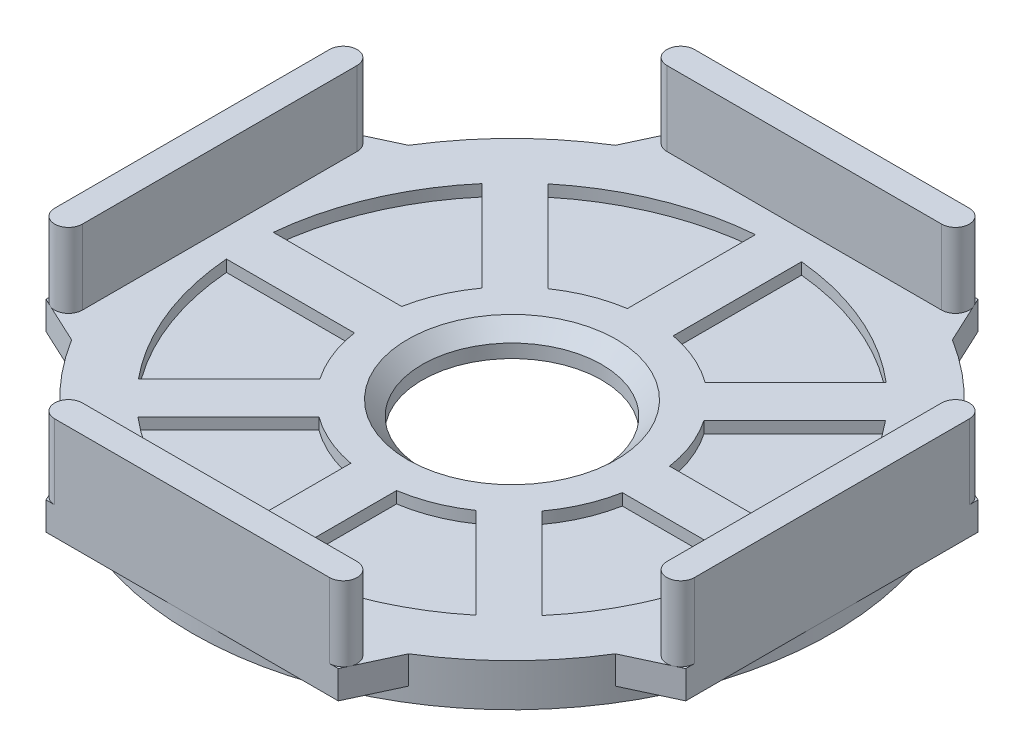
SolidWorks part; units mm, degrees
ref_plane "Plan de face" through (0, 0, 0) normal (0, 0, 1) x (1, 0, 0)
ref_plane "Plan de dessus" through (0, 0, 0) normal (0, 1, 0) x (1, 0, 0)
ref_plane "Plan de droite" through (0, 0, 0) normal (1, 0, 0) x (0, 0, -1)
sketch "Esquisse1" plane through (0, 0, 0) normal (0, 1, 0) x (1, 0, 0)
  line L0 (66.5432, 0) -> (-11.4074, 0) construction
  line L1 (0, 63.5556) -> (0, -15.7531) construction
  line L2 (44, 63.5556) -> (44, -28.5185) construction
  line L3 (66.5432, 20.1) -> (7.6049, 20.1) construction
  line L4 (44, 20.1) -> (29.5756, 26.8262) construction
  line L5 (37.4007, 23.1773) -> (44, 20.1)
  line L6 (37.4007, -23.1773) -> (44, -20.1)
  line L7 (44, 20.1) -> (44, -20.1)
  line L8 (-23.1773, -37.4007) -> (-20.1, -44)
  line L9 (20.1, -44) -> (-20.1, -44)
  line L10 (23.1773, -37.4007) -> (20.1, -44)
  line L11 (-37.4007, 23.1773) -> (-44, 20.1)
  line L12 (-44, -20.1) -> (-44, 20.1)
  line L13 (-37.4007, -23.1773) -> (-44, -20.1)
  line L14 (23.1773, 37.4007) -> (20.1, 44)
  line L15 (-20.1, 44) -> (20.1, 44)
  line L16 (-23.1773, 37.4007) -> (-20.1, 44)
  arc A0 (37.4007, 23.1773) -> (23.1773, 37.4007) centre (0, 0) ccw
  arc A1 (-23.1773, 37.4007) -> (-37.4007, 23.1773) centre (0, 0) ccw
  arc A2 (-37.4007, -23.1773) -> (-23.1773, -37.4007) centre (0, 0) ccw
  arc A3 (23.1773, -37.4007) -> (37.4007, -23.1773) centre (0, 0) ccw
  circle A4 centre (0, 0) radius 12.35
  point P30 (0, 0)
  point P32 (0, 0)
  dimension "D1" = 44
  dimension "D2" = 20.1
  dimension "D3" = 25
  dimension "D4" = 4
extrude "Boss.-Extru.1" add sketch "Esquisse1" along normal blind 3.85
sketch "Esquisse2" plane through (0, 3.85, 0) normal (0, 1, 0) x (1, 0, 0)
  line L0 (44, 29.3486) -> (44, -18.9) construction
  line L1 (57.7655, 0) -> (7.6865, 0) construction
  line L2 (57.7655, 18.9) -> (38.2343, 18.9) construction
  line L3 (42.1, 24.2521) -> (42.1, 4.6293) construction
  line L4 (44, 18.9) -> (44, -18.9)
  line L5 (40.2, 18.9) -> (40.2, -18.9)
  line L6 (18.9, -44) -> (-18.9, -44)
  line L7 (18.9, -40.2) -> (-18.9, -40.2)
  line L8 (-44, -18.9) -> (-44, 18.9)
  line L9 (-40.2, -18.9) -> (-40.2, 18.9)
  line L10 (-18.9, 44) -> (18.9, 44)
  line L11 (-18.9, 40.2) -> (18.9, 40.2)
  arc A0 (44, 18.9) -> (40.2, 18.9) centre (42.1, 18.9) ccw
  arc A1 (44, -18.9) -> (40.2, -18.9) centre (42.1, -18.9) cw
  arc A2 (18.9, -44) -> (18.9, -40.2) centre (18.9, -42.1) ccw
  arc A3 (-18.9, -44) -> (-18.9, -40.2) centre (-18.9, -42.1) cw
  arc A4 (-44, -18.9) -> (-40.2, -18.9) centre (-42.1, -18.9) ccw
  arc A5 (-44, 18.9) -> (-40.2, 18.9) centre (-42.1, 18.9) cw
  arc A6 (-18.9, 44) -> (-18.9, 40.2) centre (-18.9, 42.1) ccw
  arc A7 (18.9, 44) -> (18.9, 40.2) centre (18.9, 42.1) cw
  point P40 (0, 0)
  dimension "D1" = 18.9
  dimension "D2" = 1.9
  dimension "D3" = 4
extrude "Boss.-Extru.2" add sketch "Esquisse2" along normal blind 10.25
sketch "Esquisse3" plane through (0, 3.85, 0) normal (0, 1, 0) x (1, 0, 0)
  line L0 (0, -3.7268) -> (0, 48.565) construction
  line L1 (3.5, 55.5253) -> (3.5, 14.7908) construction
  line L2 (3.5, 36.3318) -> (3.5, 18.6748)
  line L3 (-2.2124, -3.0581) -> (34.7635, 33.9178) construction
  line L4 (30.2366, 34.3406) -> (8.4792, 12.5833) construction
  line L5 (23.6757, 27.7797) -> (11.2254, 15.3294)
  line L6 (28.1653, 23.2156) -> (15.68, 10.7302)
  line L7 (36.3845, 2.902) -> (18.7771, 2.902)
  line L8 (36.3318, -3.5) -> (18.6748, -3.5)
  line L9 (27.7797, -23.6757) -> (15.3294, -11.2254)
  line L10 (23.2156, -28.1653) -> (10.7302, -15.68)
  line L11 (2.902, -36.3845) -> (2.902, -18.7771)
  line L12 (-3.5, -36.3318) -> (-3.5, -18.6748)
  line L13 (-23.6757, -27.7797) -> (-11.2254, -15.3294)
  line L14 (-28.1653, -23.2156) -> (-15.68, -10.7302)
  line L15 (-36.3845, -2.902) -> (-18.7771, -2.902)
  line L16 (-36.3318, 3.5) -> (-18.6748, 3.5)
  line L17 (-27.7797, 23.6757) -> (-15.3294, 11.2254)
  line L18 (-23.2156, 28.1653) -> (-10.7302, 15.68)
  line L19 (-2.902, 36.3845) -> (-2.902, 18.7771)
  arc A0 (23.6757, 27.7797) -> (3.5, 36.3318) centre (0, 0) ccw
  arc A1 (36.3845, 2.902) -> (28.1653, 23.2156) centre (0, 0) ccw
  arc A2 (11.2254, 15.3294) -> (3.5, 18.6748) centre (0, 0) ccw
  arc A3 (18.7771, 2.902) -> (15.68, 10.7302) centre (0, 0) ccw
  arc A4 (27.7797, -23.6757) -> (36.3318, -3.5) centre (0, 0) ccw
  arc A5 (15.3294, -11.2254) -> (18.6748, -3.5) centre (0, 0) ccw
  arc A6 (2.902, -36.3845) -> (23.2156, -28.1653) centre (0, 0) ccw
  arc A7 (2.902, -18.7771) -> (10.7302, -15.68) centre (0, 0) ccw
  arc A8 (-23.6757, -27.7797) -> (-3.5, -36.3318) centre (0, 0) ccw
  arc A9 (-11.2254, -15.3294) -> (-3.5, -18.6748) centre (0, 0) ccw
  arc A10 (-36.3845, -2.902) -> (-28.1653, -23.2156) centre (0, 0) ccw
  arc A11 (-18.7771, -2.902) -> (-15.68, -10.7302) centre (0, 0) ccw
  arc A12 (-27.7797, 23.6757) -> (-36.3318, 3.5) centre (0, 0) ccw
  arc A13 (-15.3294, 11.2254) -> (-18.6748, 3.5) centre (0, 0) ccw
  arc A14 (-2.902, 36.3845) -> (-23.2156, 28.1653) centre (0, 0) ccw
  arc A15 (-2.902, 18.7771) -> (-10.7302, 15.68) centre (0, 0) ccw
  point P26 (0, 0)
  point P45 (0, 0)
  dimension "D1" = 3.5
  dimension "D2" = 3.5
  dimension "D4" = 8
  dimension "D3" = 45
extrude "Enlèv. mat.-Extru.1" cut sketch "Esquisse3" against normal blind 1.6
sketch "Esquisse4" plane through (0, 0, 0) normal (0, -1, 0) x (1, 0, 0)
  line L0 (0, -2.3014) -> (0, 49.2083) construction
  line L1 (2, 49.2083) -> (2, 8.7719) construction
  line L2 (0, 0) -> (37.5154, 37.5154) construction
  line L3 (5.3149, 8.1434) -> (32.984, 35.8124) construction
  line L4 (2, 40.9512) -> (2, 22.9129)
  line L5 (27.5427, 30.3711) -> (14.7876, 17.6161)
  line L6 (30.3711, 27.5427) -> (17.6161, 14.7876)
  line L7 (40.9512, 2) -> (22.9129, 2)
  line L8 (40.9512, -2) -> (22.9129, -2)
  line L9 (30.3711, -27.5427) -> (17.6161, -14.7876)
  line L10 (27.5427, -30.3711) -> (14.7876, -17.6161)
  line L11 (2, -40.9512) -> (2, -22.9129)
  line L12 (-2, -40.9512) -> (-2, -22.9129)
  line L13 (-27.5427, -30.3711) -> (-14.7876, -17.6161)
  line L14 (-30.3711, -27.5427) -> (-17.6161, -14.7876)
  line L15 (-40.9512, -2) -> (-22.9129, -2)
  line L16 (-40.9512, 2) -> (-22.9129, 2)
  line L17 (-30.3711, 27.5427) -> (-17.6161, 14.7876)
  line L18 (-27.5427, 30.3711) -> (-14.7876, 17.6161)
  line L19 (-2, 40.9512) -> (-2, 22.9129)
  circle A0 centre (0, 0) radius 44
  arc A1 (27.5427, 30.3711) -> (2, 40.9512) centre (0, 0) ccw
  arc A2 (14.7876, 17.6161) -> (2, 22.9129) centre (0, 0) ccw
  circle A3 centre (0, 0) radius 19
  arc A4 (40.9512, 2) -> (30.3711, 27.5427) centre (0, 0) ccw
  arc A5 (22.9129, 2) -> (17.6161, 14.7876) centre (0, 0) ccw
  arc A6 (30.3711, -27.5427) -> (40.9512, -2) centre (0, 0) ccw
  arc A7 (17.6161, -14.7876) -> (22.9129, -2) centre (0, 0) ccw
  arc A8 (2, -40.9512) -> (27.5427, -30.3711) centre (0, 0) ccw
  arc A9 (2, -22.9129) -> (14.7876, -17.6161) centre (0, 0) ccw
  arc A10 (-27.5427, -30.3711) -> (-2, -40.9512) centre (0, 0) ccw
  arc A11 (-14.7876, -17.6161) -> (-2, -22.9129) centre (0, 0) ccw
  arc A12 (-40.9512, -2) -> (-30.3711, -27.5427) centre (0, 0) ccw
  arc A13 (-22.9129, -2) -> (-17.6161, -14.7876) centre (0, 0) ccw
  arc A14 (-30.3711, 27.5427) -> (-40.9512, 2) centre (0, 0) ccw
  arc A15 (-17.6161, 14.7876) -> (-22.9129, 2) centre (0, 0) ccw
  arc A16 (-2, 40.9512) -> (-27.5427, 30.3711) centre (0, 0) ccw
  arc A17 (-2, 22.9129) -> (-14.7876, 17.6161) centre (0, 0) ccw
  point P45 (0, 0)
  dimension "D1" = 45
  dimension "D2" = 2
  dimension "D3" = 2
  dimension "D4" = 8
extrude "Boss.-Extru.3" add sketch "Esquisse4" along normal blind 2
chamfer "Chanfrein1" distance 2 angle 45 1 edges at (0, 3.85, 12.35)
